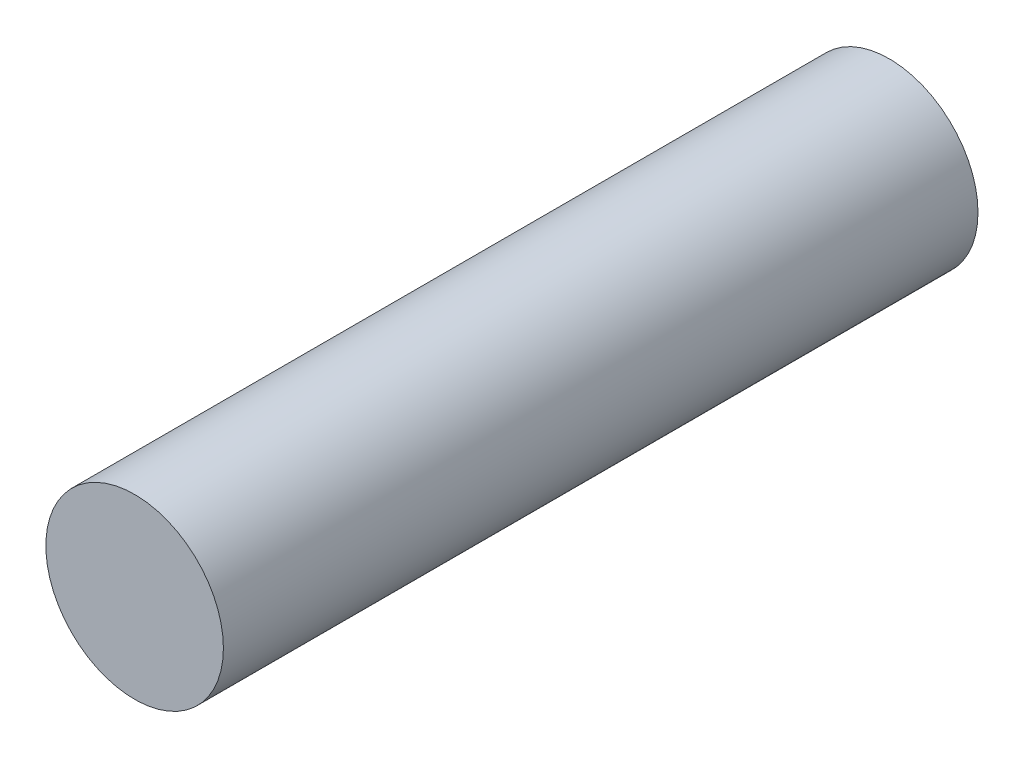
SolidWorks part; units mm, degrees
ref_plane "Face" through (0, 0, 0) normal (0, 0, 1) x (1, 0, 0)
ref_plane "Dessus" through (0, 0, 0) normal (0, 1, 0) x (1, 0, 0)
ref_plane "Droite" through (0, 0, 0) normal (1, 0, 0) x (0, 0, -1)
sketch "Esquisse1" plane through (0, 0, 0) normal (0, 0, 1) x (1, 0, 0)
  circle A0 centre (0, 0) radius 2
  dimension "D1" = 4
extrude "Base-Extrusion" add sketch "Esquisse1" against normal blind 17
